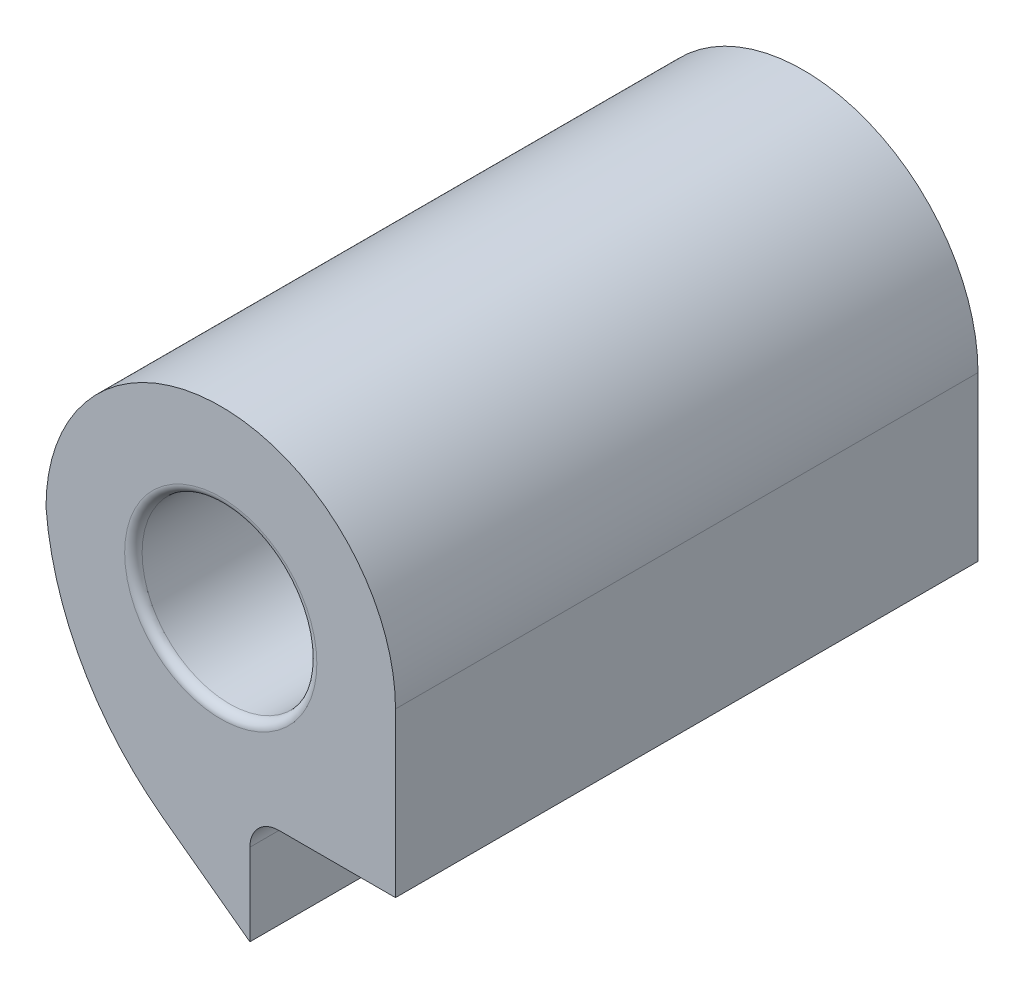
SolidWorks part; units mm, degrees
ref_plane "Front Plane" through (0, 0, 0) normal (0, 0, 1) x (1, 0, 0)
ref_plane "Top Plane" through (0, 0, 0) normal (0, 1, 0) x (1, 0, 0)
ref_plane "Right Plane" through (0, 0, 0) normal (1, 0, 0) x (0, 0, -1)
sketch "Sketch1" plane through (0, 0, 0) normal (0, 0, 1) x (1, 0, 0)
  line L0 (0, 0) -> (-12, 8.8469)
  line L2 (0, 8.8469) -> (0, 0)
  line L3 (-6, 16.1115) -> (-6, 10.1115) construction
  line L4 (-12, 13.1115) -> (-12, 8.8469)
  line L5 (0, 13.1115) -> (0, 8.8469)
  line L6 (-9, 13.1115) -> (-3, 13.1115) construction
  arc A0 (0, 13.1115) -> (-12, 13.1115) centre (-6, 13.1115) ccw
  circle A1 centre (-6, 13.1115) radius 3
  dimension "D1" = 12
  dimension "D3" = 6
extrude "Boss-Extrude1" add sketch "Sketch1" along normal blind 20 contours L5 A0 L4 L0 L2 A1
fillet "Fillet1" radius 10 1 edges at (-12, 8.8469, 10)
fillet "Fillet3" radius 0.3 2 edges at (-3, 13.1115, 0) (-3, 13.1115, 20)
sketch "Sketch2" plane through (0, 0, 20) normal (0, 0, 1) x (1, 0, 0)
  line L0 (0, 7.5) -> (-5, 7.5)
  line L1 (0, 13.1115) -> (0, 0) construction
  line L2 (-5, 7.5) -> (-5, 3.6862)
  line L3 (0, 0) -> (-7.967, 5.8737) construction
  dimension "D1" = 5
  dimension "D2" = 7.5
extrude "Cut-Extrude1" cut sketch "Sketch2" against normal through all and the other way through all
fillet "Fillet4" radius 1 1 edges at (-5, 7.5, 10)
